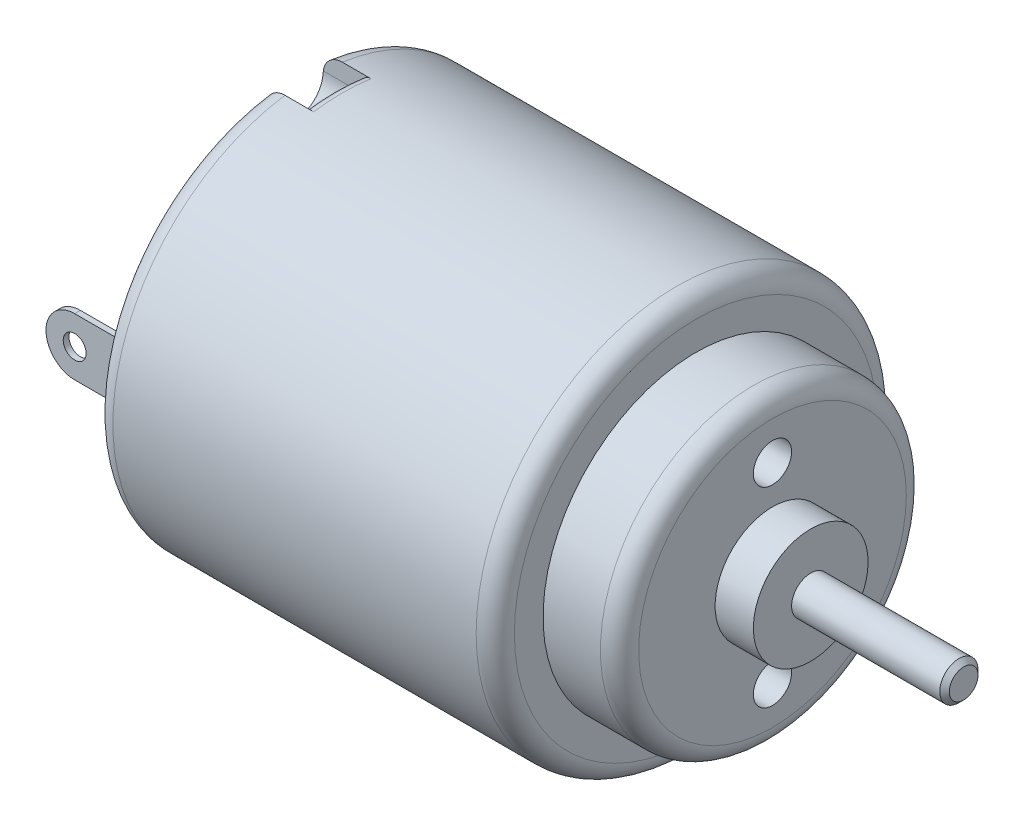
SolidWorks part; units mm, degrees
ref_plane "Plan1" through (0, 0, 0) normal (0, 0, 1) x (1, 0, 0)
ref_plane "Plan2" through (0, 0, 0) normal (0, 1, 0) x (1, 0, 0)
ref_plane "Plan3" through (0, 0, 0) normal (1, 0, 0) x (0, 0, -1)
sketch "Esquisse1" plane through (0, 0, 0) normal (0, 0, 1) x (1, 0, 0)
  line L0 (23.3, 0) -> (-102.6, 0) construction
  line L1 (-38, 0) -> (-38, 1)
  line L2 (-38, 1) -> (-37, 1)
  line L3 (-37, 1) -> (-37, 3)
  line L4 (-37, 3) -> (-35, 3)
  line L5 (-35, 3) -> (-35, 10.5)
  line L6 (-35, 10.5) -> (-14, 10.5)
  line L7 (-14, 10.5) -> (-14, 8)
  line L8 (-14, 8) -> (-10, 8)
  line L9 (-10, 8) -> (-10, 3)
  line L10 (-10, 3) -> (-8, 3)
  line L11 (-8, 3) -> (-8, 1)
  line L12 (-8, 1) -> (0, 1)
  line L13 (0, 1) -> (0, 0)
  line L14 (0, 0) -> (-38, 0)
  dimension "D1" = 1
  dimension "D2" = 1
  dimension "D3" = 3
  dimension "D4" = 2
  dimension "D5" = 10.5
  dimension "D6" = 21
  dimension "D7" = 4
  dimension "D8" = 8
  dimension "D9" = 2
  dimension "D10" = 3
  dimension "D11" = 1
  dimension "D12" = 8
revolve "Base-Révolution" add sketch "Esquisse1" angle 360 about L0
fillet "Congé1" radius 1
ref_plane "Plan4" through (0, 3, 0) normal (0, 1, 0) x (-1, 0, 0)
sketch "Esquisse4" plane through (0, 3, 0) normal (0, 1, 0) x (-1, 0, 0)
  line L0 (37, -3) -> (37, 3) construction
  line L1 (37, -3) -> (35, -3)
  line L2 (37, -3) -> (37, 3)
  line L3 (37, 3) -> (35, 3)
  line L4 (35, -3) -> (35, 3)
  point P4 (37, 0)
  dimension "D1" = 2
  dimension "D2" = 6
extrude "Enlèv. mat.-Extru.1" cut sketch "Esquisse4" against normal blind 0.5
sketch "Esquisse5" plane through (-35, 0, 0) normal (-1, 0, 0) x (0, 0, 1)
  line L1 (7.7, 1.5) -> (8, 1.5)
  line L2 (7.7, 1.5) -> (7.7, -1.5)
  line L3 (7.7, -1.5) -> (8, -1.5)
  line L4 (8, 1.5) -> (8, -1.5)
  line L5 (-8, 1.5) -> (-7.7, 1.5)
  line L6 (-8, 1.5) -> (-8, -1.5)
  line L7 (-8, -1.5) -> (-7.7, -1.5)
  line L8 (-7.7, 1.5) -> (-7.7, -1.5)
  line L9 (-13.4, 0) -> (13.5, 0) construction
  point P13 (7.7, 0)
  point P14 (-8, 0)
  dimension "D1" = 0.3
  dimension "D2" = 0.3
  dimension "D3" = 7.7
  dimension "D4" = 7.7
  dimension "D5" = 3
  dimension "D6" = 3
extrude "Boss.-Extru.1" add sketch "Esquisse5" along normal blind 3.5
sketch "Esquisse6" plane through (0, 0, -8) normal (0, 0, -1) x (-1, 0, 0)
  line L0 (38.5, 1.5) -> (38.5, -1.5) construction
  circle A0 centre (38.5, 0) radius 1.5
  dimension "D1" = 3
extrude "Boss.-Extru.2" add sketch "Esquisse6" against normal blind 0.3
sketch "Esquisse7" plane through (0, 0, 7.7) normal (0, 0, -1) x (-1, 0, 0)
  line L0 (38.5, 1.5) -> (38.5, -1.5) construction
  circle A0 centre (38.5, 0) radius 1.5
  dimension "D1" = 3
extrude "Boss.-Extru.3" add sketch "Esquisse7" against normal blind 0.3
sketch "Esquisse8" plane through (0, 0, -8) normal (0, 0, -1) x (-1, 0, 0)
  circle A0 centre (38.5, 0) radius 0.6
  dimension "D1" = 1.2
extrude "Enlèv. mat.-Extru.2" cut sketch "Esquisse8" against normal blind 0.3
sketch "Esquisse9" plane through (0, 0, 7.7) normal (0, 0, -1) x (-1, 0, 0)
  circle A0 centre (38.5, 0) radius 0.6
  dimension "D1" = 1.2
extrude "Enlèv. mat.-Extru.3" cut sketch "Esquisse9" against normal blind 0.3
chamfer "Chanfrein1" distance 0.25 angle 45
sketch "Esquisse10" plane through (-10, 0, 0) normal (1, 0, 0) x (0, 0, -1)
  line L0 (0, 7.4) -> (0, -8.6) construction
  circle A0 centre (0, 5) radius 1
  circle A1 centre (0, -5) radius 1
  dimension "D1" = 2
  dimension "D2" = 2
  dimension "D5" = 10
  dimension "D3" = 5
  dimension "D4" = 5
extrude "Enlèv. mat.-Extru.4" cut sketch "Esquisse10" against normal blind 2
sketch "Esquisse11" plane through (-35, 0, 0) normal (-1, 0, 0) x (0, 0, 1)
  line L0 (1.5, 10.5) -> (1.5, 9.5)
  line L1 (-1.5, 10.5) -> (-1.5, 9.5)
  line L2 (-1.5, -9.5) -> (-1.5, -10.5)
  line L3 (1.5, -9.5) -> (1.5, -10.5)
  line L4 (-1.5, 10.5) -> (1.5, 10.5)
  line L5 (-1.5, -10.5) -> (1.5, -10.5)
  arc A0 (-1.5, 9.5) -> (1.5, 9.5) centre (0, 9.5) ccw
  circle A1 centre (0, 0) radius 9.5 construction
  arc A2 (1.5, -9.5) -> (-1.5, -9.5) centre (0, -9.5) ccw
  dimension "D1" = 19
  dimension "D2" = 9.5
  dimension "D3" = 1.5
  dimension "D4" = 3
  dimension "D5" = 21
  dimension "D6" = 10.5
extrude "Enlèv. mat.-Extru.5" cut sketch "Esquisse11" against normal blind 2
fillet "Congé2" radius 0.5
fillet "Congé3" radius 0.5
